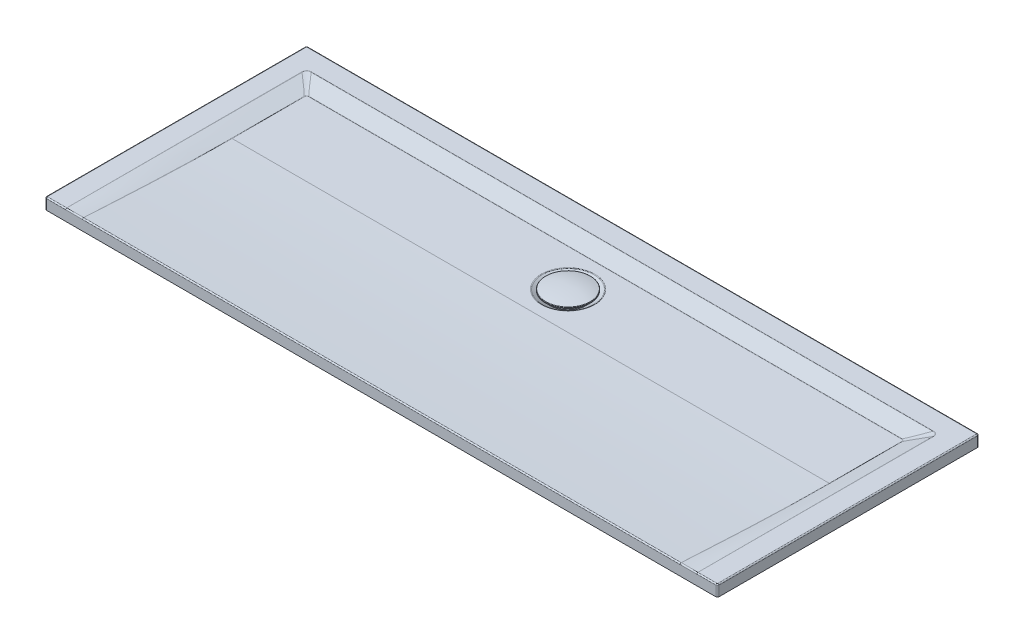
SolidWorks part; units mm, degrees
ref_plane "Płaszczyzna przednia" through (0, 0, 0) normal (0, 0, 1) x (1, 0, 0)
ref_plane "Płaszczyzna górna" through (0, 0, 0) normal (0, 1, 0) x (1, 0, 0)
ref_plane "Płaszczyzna prawa" through (0, 0, 0) normal (1, 0, 0) x (0, 0, -1)
sketch "Szkic1" plane through (0, 0, 0) normal (0, 1, 0) x (1, 0, 0)
  line L0 (0, 350) -> (0, -350) construction
  line L1 (-900, 350) -> (900, 350)
  line L2 (-900, 350) -> (-900, -350)
  line L3 (-900, -350) -> (900, -350)
  line L4 (900, 350) -> (900, -350)
  line L5 (-845, -350) -> (-845, 295)
  line L6 (-845, 295) -> (845, 295)
  line L7 (845, 295) -> (845, -350)
  line L8 (-800, -350) -> (-800, 250)
  line L9 (-800, 250) -> (800, 250)
  line L10 (800, 250) -> (800, -350)
  circle A0 centre (0, 150) radius 45
  circle A1 centre (0, 150) radius 70
  point P9 (0, 295)
  dimension "D6" = 90
  dimension "D7" = 140
  dimension "D1" = 1800
  dimension "D2" = 55
  dimension "D3" = 55
  dimension "D5" = 200
  dimension "D8" = 700
  dimension "D4" = 45
sketch "Szkic2" plane through (0, 0, 0) normal (0, 1, 0) x (1, 0, 0)
  line L0 (-900, -350) -> (900, -350) construction
  line L1 (900, 350) -> (900, -350) construction
  line L2 (845, 295) -> (845, -350) construction
  line L3 (-845, 295) -> (845, 295) construction
  line L4 (-900, 350) -> (900, 350) construction
  line L5 (-845, -350) -> (-845, 295) construction
  line L6 (-900, 350) -> (-900, -350) construction
  line L7 (-900, -350) -> (-845, -350)
  line L8 (900, 350) -> (900, -350)
  line L9 (845, 295) -> (845, -350)
  line L10 (-845, 295) -> (845, 295)
  line L11 (-900, 350) -> (900, 350)
  line L12 (-845, -350) -> (-845, 295)
  line L13 (-900, 350) -> (-900, -350)
  line L14 (845, -350) -> (900, -350)
surface "Powierzchnia-Płaszczyzna1" sketch "Szkic2"
ref_plane "Płaszczyzna1" through (0, -15, 0) normal (0, 1, 0) x (-1, 0, 0)
sketch "Szkic3" plane through (0, -15, 0) normal (0, 1, 0) x (-1, 0, 0)
  line L0 (800, -50) -> (-800, -50)
  line L1 (800, 350) -> (800, -250) construction
  line L2 (-800, -250) -> (-800, 350) construction
  line L3 (0, -50) -> (0, -250) construction
  line L4 (800, -250) -> (-800, -250) construction
  line L5 (-800, -250) -> (-800, -50)
  line L6 (800, -50) -> (800, -250)
  line L7 (800, -250) -> (-800, -250)
  circle A0 centre (0, -150) radius 70 construction
  circle A1 centre (0, -150) radius 70
  point P10 (0, -150)
surface "Powierzchnia-Płaszczyzna2" sketch "Szkic3"
sketch "Szkic4" plane through (0, 0, 0) normal (0, 1, 0) x (1, 0, 0)
  line L0 (800, -350) -> (-800, -350)
other "Granica-Powierzchnia1"
other "Granica-Powierzchnia2"
other "Granica-Powierzchnia3"
mirror "Lustro1" about plane through (0, 0, 0) normal (1, 0, 0)
sketch "Szkic5" plane through (0, 0, 0) normal (0, 1, 0) x (1, 0, 0)
  line L0 (900, 350) -> (900, -350) construction
  line L1 (-900, 350) -> (900, 350) construction
  line L2 (-900, 350) -> (-900, -350) construction
  line L3 (-900, -350) -> (900, -350) construction
  line L4 (900, 350) -> (900, -350)
  line L5 (-900, 350) -> (900, 350)
  line L6 (-900, 350) -> (-900, -350)
  line L7 (-900, -350) -> (900, -350)
surface "Powierzchnia-Wyciągnięcie1" sketch "Szkic5" parameters "D1"=30
sketch "Szkic7" plane through (0, 0, 0) normal (1, 0, 0) x (0, 0, -1)
  line L0 (150, 0) -> (150, -30) construction
  line L1 (350, -30) -> (-350, -30) construction
  line L2 (195, -30) -> (195, -28)
  line L3 (195, -28) -> (199, -28)
  line L6 (199, -28) -> (220, -15)
  dimension "D1" = 90
  dimension "D2" = 2
  dimension "D3" = 98
surface "Powierzchnia-Obrót wokół linii środkowej1" sketch "Szkic7" parameters "D1"=360
surface "Powierzchnia-Płaszczyzna3"
surface "Powierzchnia-Połącz1"
fillet "Zaokrąglenie1" radius 4 6 edges at (0, -28, -199) (0, -15, -80) (900, -15, 350) (900, -15, -350) (-900, -15, -350) (-900, -15, 350)
fillet "Zmienne zaokrąglenie1" radius 40 2 edges at (822.5, -7.5, -272.5)
fillet "Zaokrąglenie3" radius 3 12 edges
fillet "Zaokrąglenie4" radius 3 12 edges at (-898.8284, 0, -348.8284) (0, 0, -350) (898.8284, 0, -348.8284) (900, 0, 0) (898.8284, 0, 348.8284) (870.5, 0, 350) (-870.5, 0, 350) (-898.8284, 0, 348.8284) (-900, 0, 0)
sketch "Szkic8" plane through (0, 0, 0) normal (1, 0, 0) x (0, 0, -1)
  line L0 (150, 0) -> (150, -30) construction
  line L1 (150, -5.6601) -> (179.8469, -5.6601) construction
  line L2 (210, -14.7573) -> (210, -17)
  line L3 (210, -17) -> (150, -17)
  line L4 (150, -17) -> (150, -5.6601)
  line L5 (150, -5.6601) -> (199.9922, 95.6514)
  arc A0 (150, -5.6601) -> (209.2694, -13.7943) centre (150, -225.6601) cw
  arc A1 (209.2694, -13.7943) -> (210, -14.7573) centre (209, -14.7573) cw
  point P11 (210, -14)
  dimension "D1" = 220
  dimension "D4" = 1
  dimension "D2" = 60
  dimension "D3" = 3
  dimension "D5" = 13
revolve "Obrót wokół linii środkowej1" add sketch "Szkic8" angle 360 about L4
